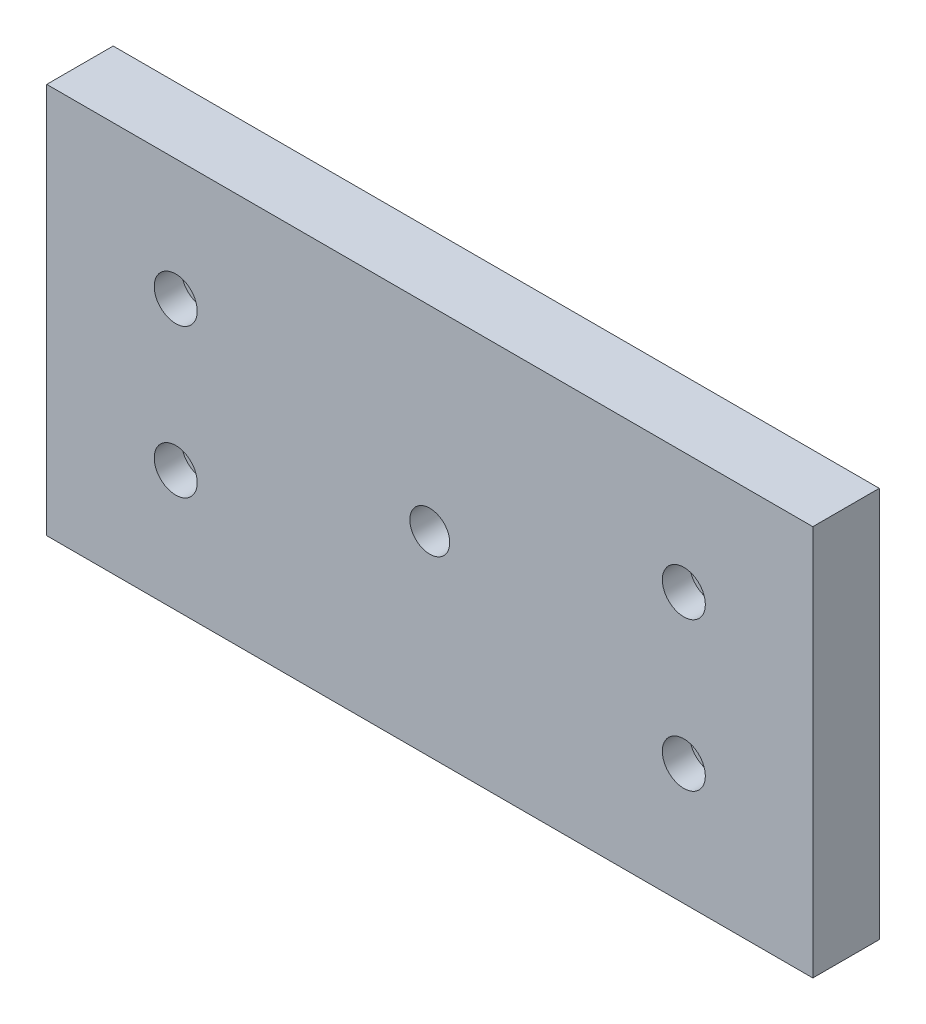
SolidWorks part; units mm, degrees
ref_plane "Face" through (0, 0, 0) normal (0, 0, 1) x (1, 0, 0)
ref_plane "Dessus" through (0, 0, 0) normal (0, 1, 0) x (1, 0, 0)
ref_plane "Droite" through (0, 0, 0) normal (1, 0, 0) x (0, 0, -1)
sketch "Esquisse1" plane through (0, 0, 0) normal (0, 0, 1) x (1, 0, 0)
  line L1 (0, 0) -> (196, 0)
  line L2 (0, 0) -> (0, 100)
  line L3 (0, 100) -> (196, 100)
  line L4 (196, 0) -> (196, 100)
  dimension "D1" = 196
  dimension "D2" = 100
extrude "Extrusion1" add sketch "Esquisse1" along normal blind 17
hole_wizard "Trou taraudé M12x1.751" positions "Esquisse3D1" profile "Esquisse3" tap size "M12x1.75" standard "ISO"
sketch3d "Esquisse3D1"
  line L0 (196, 0, 17) -> (196, 100, 17) construction
  line L1 (0, 0, 17) -> (196, 0, 17) construction
  point P0 (98, 50, 17)
  dimension "D1" = 98
  dimension "D2" = 50
sketch "Esquisse3" plane through (98, 50, 17) normal (1, 0, 0) x (0, -1, 0)
  line L0 (0, 0) -> (0, 16.3144)
  line L1 (0, 16.3144) -> (5.1, 13.25)
  line L2 (5.1, 13.25) -> (5.1, 0)
  line L5 (5.1, 0) -> (0, 0)
  line L10 (0, 16.3144) -> (-5.1, 13.25) construction
  line L11 (0, -6.35) -> (0, 107.95) construction
  dimension "Diamètre du trou pour taraudage" = 10.2
  dimension "Profondeur du trou pour taraudage" = 13.25
  dimension "Angle de pointe" = 118
hole_wizard "Chambrage pour vis à tête hexagonale M62" positions "Esquisse6" profile "Esquisse5" counterbore size "M6" standard "ISO"
sketch "Esquisse6" plane through (0, 0, 17) normal (0, 0, 1) x (1, 0, 0)
  line L0 (98, 100) -> (98, 0) construction
  line L1 (196, 100) -> (0, 100) construction
  line L2 (0, 0) -> (196, 0) construction
  line L3 (196, 50) -> (0, 50) construction
  line L4 (196, 0) -> (196, 100) construction
  line L5 (0, 100) -> (0, 0) construction
  point P0 (33, 69)
  point P13 (163, 69)
  point P14 (33, 31)
  point P15 (163, 31)
  dimension "D1" = 65
  dimension "D2" = 19
sketch "Esquisse5" plane through (33, 69, 17) normal (1, 0, 0) x (0, -1, 0)
  line L0 (0, 0) -> (0, 17)
  line L1 (0, 17) -> (3.3, 17)
  line L3 (3.3, 17) -> (3.3, 7)
  line L4 (3.3, 7) -> (5.5, 7)
  line L5 (5.5, 7) -> (5.5, 0)
  line L7 (5.5, 0) -> (0, 0)
  line L11 (0, -6.35) -> (0, 107.95) construction
  dimension "Diamètre du perçage jusqu'au prochain" = 6.6
  dimension "Profondeur du perçage jusqu'au prochain" = 17
  dimension "Diamètre du chambrage" = 11
  dimension "Profondeur du chambrage" = 7
